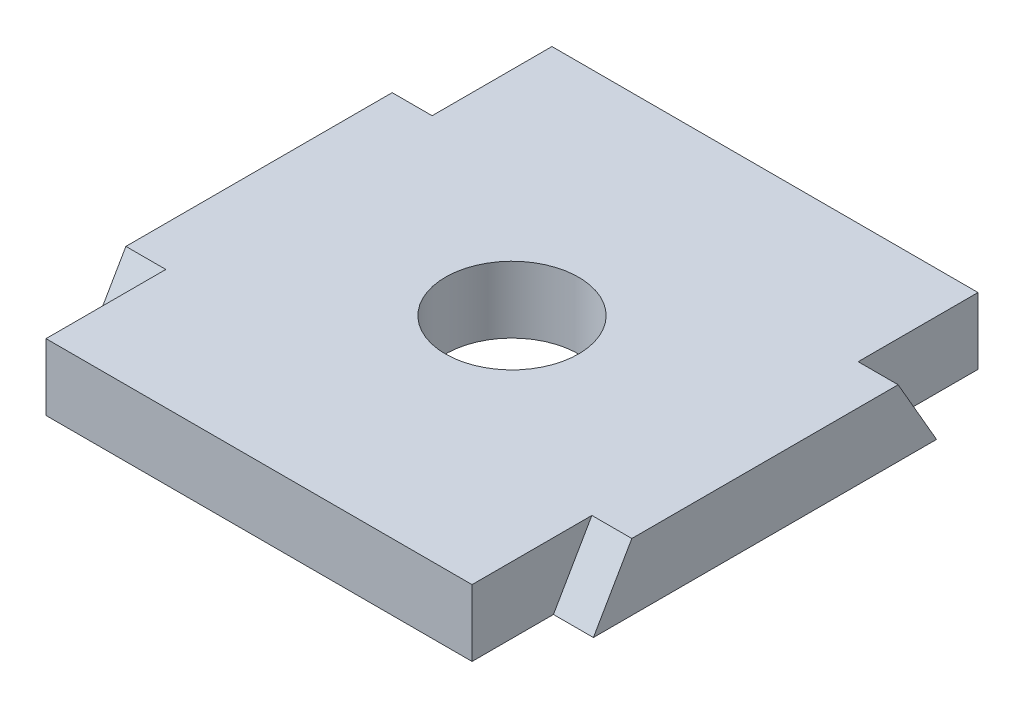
SolidWorks part; units mm, degrees
ref_plane "Front" through (0, 0, 0) normal (0, 0, 1) x (1, 0, 0)
ref_plane "Top" through (0, 0, 0) normal (0, 1, 0) x (1, 0, 0)
ref_plane "Right" through (0, 0, 0) normal (1, 0, 0) x (0, 0, -1)
sketch "Sketch1" plane through (0, 0, 0) normal (0, 1, 0) x (1, 0, 0)
  line L0 (3, 0) -> (3, 9)
  line L1 (3, 0) -> (35, 0)
  line L2 (0, 9) -> (0, 29)
  line L3 (3, 38) -> (35, 38)
  line L4 (38, 9) -> (38, 29)
  line L5 (35, 0) -> (35, 9)
  line L7 (0, 29) -> (3, 29)
  line L8 (0, 9) -> (3, 9)
  line L10 (38, 0) -> (38, 38) construction
  line L11 (0, 38) -> (38, 38) construction
  line L12 (0, 0) -> (0, 38) construction
  line L13 (0, 0) -> (38, 0) construction
  line L14 (35, 29) -> (38, 29)
  line L15 (0, 29) -> (38, 29) construction
  line L16 (3, 29) -> (3, 38)
  line L17 (3, 0) -> (3, 38) construction
  line L18 (35, 9) -> (38, 9)
  line L19 (0, 9) -> (38, 9) construction
  line L20 (35, 29) -> (35, 38)
  line L21 (35, 0) -> (35, 38) construction
  circle A0 centre (19, 19) radius 5
extrude "Extrude1" add sketch "Sketch1" along normal blind 5
sketch "Sketch2" plane through (38, 0, 0) normal (1, 0, 0) x (0, 0, -1)
  line L0 (29, 5) -> (31.8868, 0)
  line L1 (9, 5) -> (9, 0)
  line L2 (29, 5) -> (29, 0)
  line L3 (29, 0) -> (31.8868, 0)
  line L5 (9, 0) -> (6.1132, 0)
  line L6 (9, 5) -> (6.1132, 0)
extrude "Extrude2" add sketch "Sketch2" against normal blind 38
